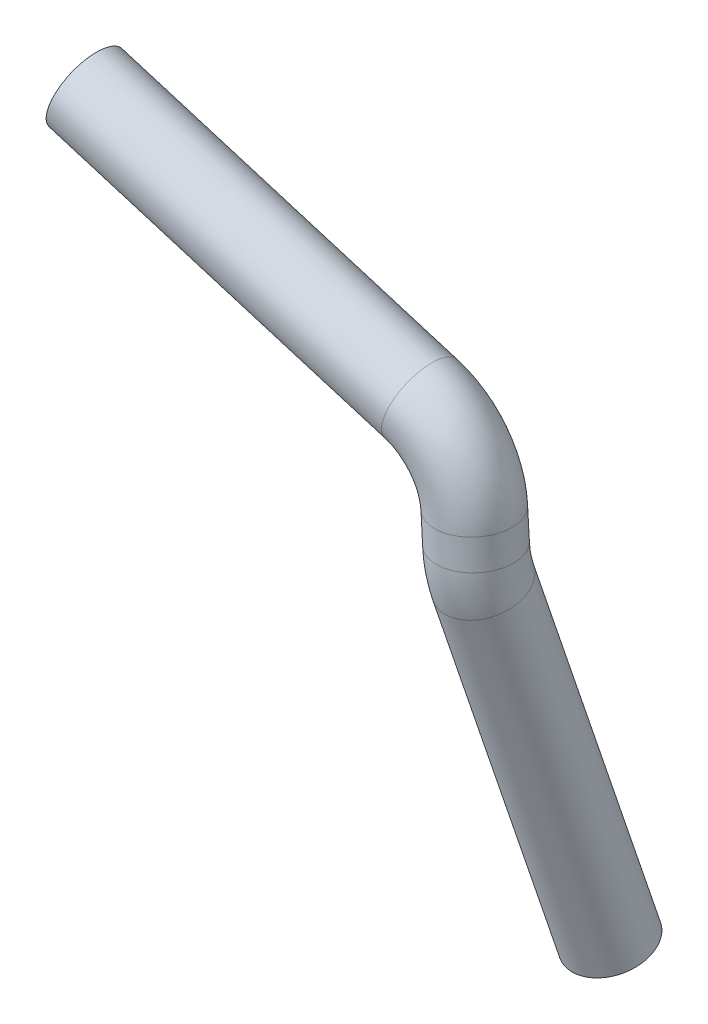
SolidWorks part; units mm, degrees
ref_plane "Plan de face" through (0, 0, 0) normal (0, 0, 1) x (1, 0, 0)
ref_plane "Plan de dessus" through (0, 0, 0) normal (0, 1, 0) x (1, 0, 0)
ref_plane "Plan de droite" through (0, 0, 0) normal (1, 0, 0) x (0, 0, -1)
sketch "Esquisse1" plane through (0, 0, 0) normal (0, 0, 1) x (1, 0, 0)
  line L0 (-35.8506, 0) -> (39.8339, 0) construction
ref_plane "Plan1" through (0, 0, 0) normal (0, -0.2756, 0.9613) x (1, 0, 0)
sketch3d "Esquisse3D2"
  line L0 (-155.3465, 86.2863, 0) -> (-22.3118, 46.024, 0)
  line L1 (-1.0476, 18.9649, 0) -> (-0.388, 7.0234, 0)
  line L2 (0.5455, -6.7413, -1.933) -> (11.6328, -143.755, -41.2211)
  arc A0 (-0.388, 7.0234, 0) -> (0.5455, -6.7413, -1.933) centre (4.0587, 7.269, -49.8013) ccw
  arc A1 (-22.3118, 46.024, 0) -> (-1.0476, 18.9649, 0) centre (-31.0019, 17.3102, 0) ccw
  point P7 (0, 0, 0)
  point P8 (53.7842, 10.0159, -45.3478)
  point P11 (-2.2062, 39.9391, 0)
  point P12 (-31.0019, 17.3102, -30)
  dimension "D1" = 50
  dimension "D5" = 30
  dimension "D7" = 30
  dimension "D2" = 40
  dimension "D3" = 160
  dimension "D4" = 150
  dimension "D6" = 110
ref_plane "Plan2" through (11.6328, -143.755, -41.2211) normal (0.0776, -0.9584, -0.2748) x (0.997, 0.0745, 0.0214)
sketch "Esquisse2" plane through (11.6328, -143.755, -41.2211) normal (0.0776, -0.9584, -0.2748) x (0.997, 0.0745, 0.0214)
  circle A0 centre (0, 0) radius 15
  circle A1 centre (0, 0) radius 13
  dimension "D1" = 30
  dimension "D2" = 26
sweep "Balayage1" add profiles "Esquisse2" path "Esquisse3D2"
